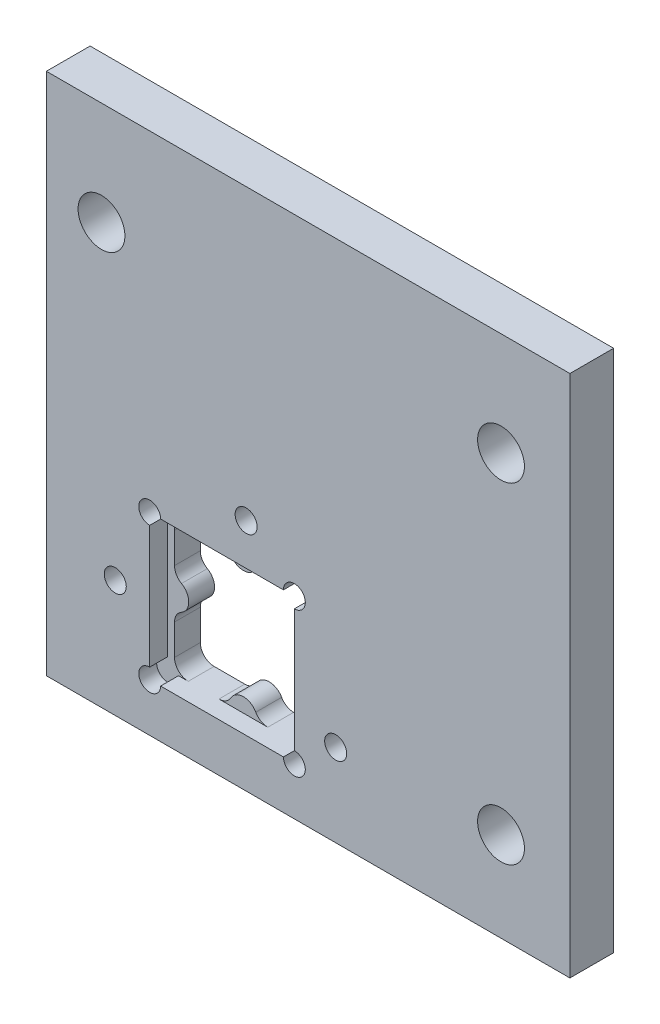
SolidWorks part; units mm, degrees
ref_plane "Front Plane" through (0, 0, 0) normal (0, 0, 1) x (1, 0, 0)
ref_plane "Top Plane" through (0, 0, 0) normal (0, 1, 0) x (1, 0, 0)
ref_plane "Right Plane" through (0, 0, 0) normal (1, 0, 0) x (0, 0, -1)
sketch "Sketch1" plane through (0, 0, 0) normal (0, 0, 1) x (1, 0, 0)
  line L1 (-19, -19) -> (19, -19)
  line L2 (-19, -19) -> (-19, 19)
  line L3 (-19, 19) -> (19, 19)
  line L4 (19, -19) -> (19, 19)
  line L5 (-19, -19) -> (19, 19) construction
  line L6 (-19, 19) -> (19, -19) construction
  point P1 (0, 0)
  dimension "D1" = 38
  dimension "D2" = 38
extrude "Boss-Extrude1" add sketch "Sketch1" along normal blind 3.175
sketch "Sketch2" plane through (0, 0, 3.175) normal (0, 0, 1) x (1, 0, 0)
  line L0 (-6, -5.5) -> (-6, -15.5) construction
  line L1 (-11, -15.5) -> (-1, -15.5) construction
  line L2 (-11, -15.5) -> (-11, -5.5) construction
  line L3 (-11, -5.5) -> (-1, -5.5) construction
  line L4 (-1, -15.5) -> (-1, -5.5) construction
  line L5 (-11, -15.5) -> (-1, -5.5) construction
  line L6 (-11, -5.5) -> (-1, -15.5) construction
  line L7 (-11, -10.5) -> (-1, -10.5) construction
  line L8 (-6, -5.5) -> (-1, -10.5) construction
  line L9 (-1, -10.5) -> (-6, -15.5) construction
  line L10 (-6, -15.5) -> (-11, -10.5) construction
  line L11 (-11, -10.5) -> (-6, -5.5) construction
  line L12 (-11, -5.5) -> (-11, -9.4645)
  line L13 (-11, -11.5355) -> (-11, -15.5)
  line L14 (-11, -5.5) -> (-7.0355, -5.5)
  line L15 (-4.9645, -5.5) -> (-1, -5.5)
  line L16 (-4.9645, -15.5) -> (-1, -15.5)
  line L17 (-1, -15.5) -> (-1, -11.5355)
  line L18 (-1, -5.5) -> (-1, -9.4645)
  line L20 (19, 19) -> (-19, 19) construction
  line L21 (-11, -15.5) -> (-7.0355, -15.5)
  line L22 (19, -19) -> (19, 19) construction
  arc A0 (-4.9645, -5.5) -> (-7.0355, -5.5) centre (-6, -5.5) cw
  circle A1 centre (-8.5, -13) radius 2.5 construction
  arc A2 (-11, -11.5355) -> (-11, -9.4645) centre (-11, -10.5) ccw
  circle A3 centre (-3.5, -8) radius 2.5 construction
  circle A4 centre (-8.5, -8) radius 2.5 construction
  arc A5 (-7.0355, -15.5) -> (-4.9645, -15.5) centre (-6, -15.5) cw
  arc A6 (-1, -9.4645) -> (-1, -11.5355) centre (-1, -10.5) ccw
  point P0 (-6, -10.5)
  dimension "D1" = 10
  dimension "D2" = 10
  dimension "D3" = 25
  dimension "D4" = 29.5
extrude "Cut-Extrude1" cut sketch "Sketch2" against normal through all
fillet "Fillet2" radius 1 12 edges at (-7.0355, -5.5, 1.5875) (-4.9645, -5.5, 1.5875) (-11, -9.4645, 1.5875) (-11, -11.5355, 1.5875) (-11, -5.5, 1.5875) (-11, -15.5, 1.5875) (-7.0355, -15.5, 1.5875) (-4.9645, -15.5, 1.5875) (-1, -15.5, 1.5875) (-1, -11.5355, 1.5875) (-1, -9.4645, 1.5875) (-1, -5.5, 1.5875)
sketch "Sketch4" plane through (0, 0, 3.175) normal (0, 0, 1) x (1, 0, 0)
  line L1 (-11.5, -5) -> (-1, -5)
  line L2 (-11.5, -5) -> (-11.5, -15.5)
  line L3 (-11.5, -15.5) -> (-1, -15.5)
  line L4 (-1, -5) -> (-1, -15.5)
  line L5 (-1, -14.5) -> (-1, -12.273) construction
  line L6 (-4.227, -15.5) -> (-2, -15.5) construction
  dimension "D1" = 10.5
  dimension "D2" = 10.5
extrude "Cut-Extrude2" cut sketch "Sketch4" against normal blind 1.3
hole_wizard "M2x0.4 Tapped Hole1" positions "Sketch10" profile "Sketch9" tap size "M2x0.4" standard "ANSI Metric"
sketch "Sketch10" plane through (0, 0, 3.175) normal (0, 0, 1) x (1, 0, 0)
  line L2 (-14, 13.2988) -> (-14, -49986.7012) construction
  line L11 (-11, -14.5) -> (-11, -12.273) construction
  line L12 (-1, -5) -> (-11.5, -5) construction
  line L16 (-1, -15.5) -> (-1, -5) construction
  line L17 (-11.5, -15.5) -> (-1, -15.5) construction
  line L18 (-10, -5.5) -> (-7.773, -5.5) construction
  point P0 (-14, -10.5)
  point P2 (-4.5, -2)
  point P4 (2, -13)
  dimension "D1" = 3
  dimension "D2" = 3
  dimension "D3" = 3
  dimension "D4" = 5
  dimension "D5" = 2.5
  dimension "D6" = 3.5
sketch "Sketch9" plane through (-14, -10.5, 3.175) normal (1, 0, 0) x (0, -1, 0)
  line L0 (0, 0) -> (0, 3.175)
  line L1 (0, 3.175) -> (0.8, 3.175)
  line L2 (0.8, 3.175) -> (0.8, 0)
  line L5 (0.8, 0) -> (0, 0)
  line L11 (0, -6.35) -> (0, 107.95) construction
  dimension "Thru Tap Drill Dia." = 1.6
  dimension "Thru Tap Drill Depth" = 3.175
sketch "Sketch11" plane through (0, 0, 3.175) normal (0, 0, 1) x (1, 0, 0)
  line L0 (14, 20.4436) -> (14, -49979.5564) construction
  line L1 (30.7006, 11.5) -> (50030.7006, 11.5) construction
  line L2 (19, 19) -> (-19, 19) construction
  line L4 (19, -19) -> (19, 19) construction
  circle A0 centre (14, -12.5) radius 1.7
  circle A1 centre (14, 11.5) radius 1.7
  circle A2 centre (-15, 11.5) radius 1.7
  point P0 (14, -12.5)
  point P1 (14, 11.5)
  point P2 (-15, 11.5)
  dimension "D5" = 3.4
  dimension "D6" = 3.4
  dimension "D7" = 3.4
  dimension "D1" = 7.5
  dimension "D2" = 31.5
  dimension "D3" = 29
  dimension "D4" = 5
extrude "Cut-Extrude3" cut sketch "Sketch11" against normal through all
hole_wizard "1/16 (0.0625) Dowel Hole1" positions "3DSketch3" profile "Sketch14" hole size "1/16" standard "ANSI Inch"
sketch3d "3DSketch3"
  point P0 (-11.5, -5, 3.175)
  point P2 (-1, -5, 3.175)
  point P4 (-1, -15.5, 3.175)
  point P6 (-11.5, -15.5, 3.175)
sketch "Sketch14" plane through (-11.5, -5, 3.175) normal (1, 0, 0) x (0, -1, 0)
  line L0 (0, 0) -> (0, 1.7759)
  line L1 (0, 1.7759) -> (0.7937, 1.299)
  line L2 (0.7937, 1.299) -> (0.7937, 0)
  line L5 (0.7937, 0) -> (0, 0)
  line L10 (0, 1.7759) -> (-0.7938, 1.299) construction
  line L11 (0, -6.35) -> (0, 107.95) construction
  dimension "Hole Dia." = 1.5875
  dimension "Hole Depth" = 1.299
  dimension "Drill Angle" = 118
